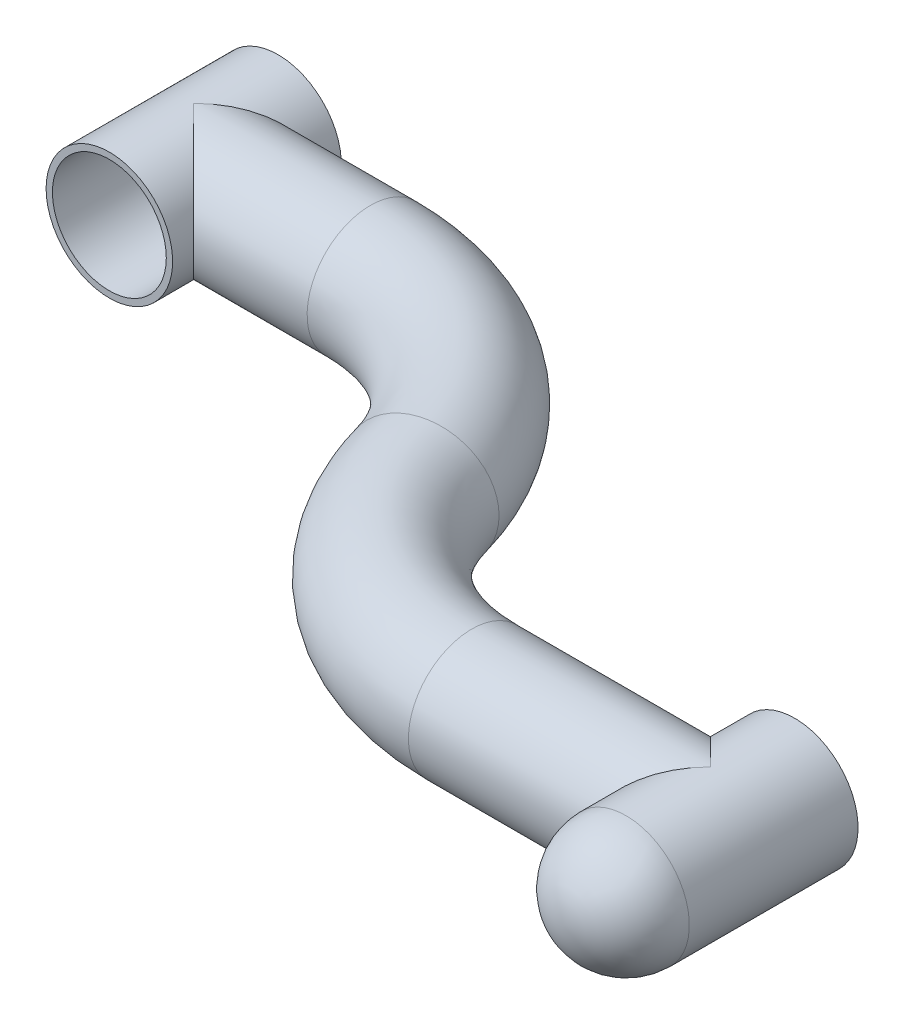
SolidWorks part; units mm, degrees
ref_plane "Plan de face" through (0, 0, 0) normal (0, 0, 1) x (1, 0, 0)
ref_plane "Plan de dessus" through (0, 0, 0) normal (0, 1, 0) x (1, 0, 0)
ref_plane "Plan de droite" through (0, 0, 0) normal (1, 0, 0) x (0, 0, -1)
sketch "Esquisse1" plane through (0, 0, 0) normal (0, 1, 0) x (1, 0, 0)
  line L0 (0, 0) -> (-113.2035, 0)
  line L1 (-311.2236, 150) -> (-395, 150)
  arc A0 (-113.2035, 0) -> (-212.2136, 75) centre (-113.2035, 102.8533) cw
  arc A1 (-212.2136, 75) -> (-311.2236, 150) centre (-311.2236, 47.1467) ccw
  dimension "D1" = 395
  dimension "D2" = 150
sketch "Esquisse2" plane through (0, 0, 0) normal (1, 0, 0) x (0, 0, -1)
  circle A0 centre (0, 0) radius 30
  circle A1 centre (0, 0) radius 27
  dimension "D1" = 3
  dimension "D2" = 60
sweep "Balayage1" add profiles "Esquisse2" path "Esquisse1"
sketch "Esquisse3" plane through (0, 0, 0) normal (0, 1, 0) x (1, 0, 0)
  line L0 (0, -30) -> (0, 30) construction
  line L1 (0, 40) -> (30, 40)
  line L2 (0, 40) -> (0, -40)
  line L3 (0, -40) -> (30, -40)
  line L4 (30, 40) -> (30, -40)
  dimension "D1" = 30
  dimension "D2" = 80
revolve "Révolution1" add sketch "Esquisse3" angle 360 about L2
sketch "Esquisse4" plane through (0, 0, 0) normal (0, 1, 0) x (1, 0, 0)
  line L0 (-395, 180) -> (-395, 120) construction
  line L1 (-395, 190) -> (-425, 190)
  line L2 (-395, 190) -> (-395, 110)
  line L3 (-395, 110) -> (-425, 110)
  line L4 (-425, 190) -> (-425, 110)
  line L6 (-395, 150) -> (-1676.3089, 150) construction
  line L7 (-395, 177) -> (-395, 123) construction
  dimension "D1" = 30
  dimension "D2" = 80
revolve "Révolution2" add sketch "Esquisse4" angle 360 about L2
sketch "Esquisse5" plane through (0, 0, 40) normal (0, 0, 1) x (1, 0, 0)
  circle A2 centre (0, 0) radius 27
  circle A3 centre (0, 0) radius 27
  circle A5 centre (-395, 0) radius 27
  circle A6 centre (-395, 0) radius 27
  dimension "D1" = 3
  dimension "D2" = 3
extrude "Enlèv. mat.-Extru.1" cut sketch "Esquisse5" against normal through all
sketch "Esquisse6" plane through (0, 0, 0) normal (0, 1, 0) x (1, 0, 0)
  line L0 (0, 74.7521) -> (0, -103.2471) construction
  line L1 (0, -40) -> (0, 40) construction
  line L2 (-30, -40) -> (0, -40)
  line L3 (-30, -40) -> (30, -40) construction
  line L4 (0, -40) -> (0, -70)
  arc A0 (0, -70) -> (-30, -40) centre (0, -40) cw
revolve "Révolution3" add sketch "Esquisse6" angle 360 about L4
